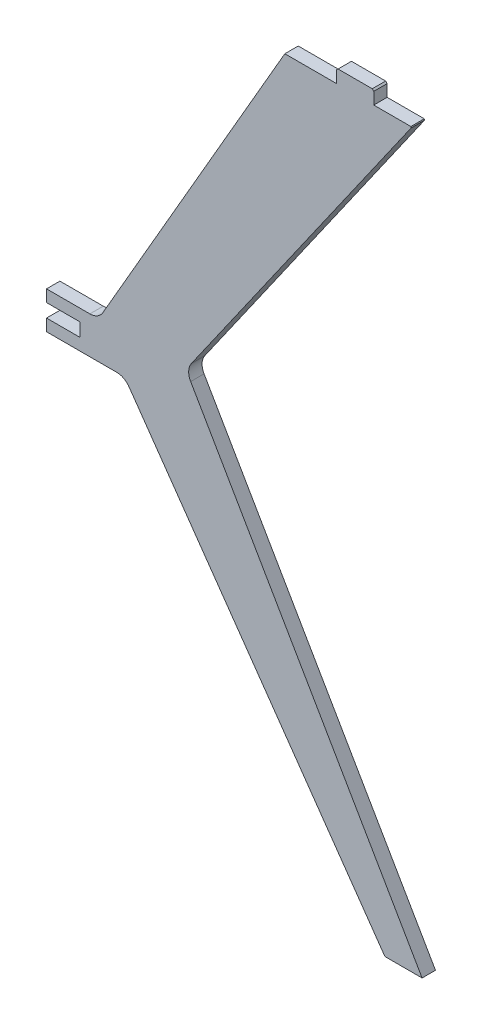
SolidWorks part; units mm, degrees
ref_plane "Alzado" through (0, 0, 0) normal (0, 0, 1) x (1, 0, 0)
ref_plane "Planta" through (0, 0, 0) normal (0, 1, 0) x (1, 0, 0)
ref_plane "Vista lateral" through (0, 0, 0) normal (1, 0, 0) x (0, 0, -1)
sketch "Croquis1" plane through (0, 0, 0) normal (0, 0, 1) x (1, 0, 0)
  line L0 (0, 0) -> (-317.5426, 550)
  line L4 (-400.1038, 500) -> (-50, 0)
  line L5 (-50, 0) -> (0, 0)
  line L6 (-400.1038, 500) -> (-505, 500)
  line L7 (-505, 550) -> (-505, 500) construction
  line L8 (-505, 550) -> (-435.1141, 550)
  line L9 (-435.1141, 550) -> (-184.5441, 984)
  line L10 (-400.1038, 500) -> (-435.1141, 550) construction
  line L11 (-505, 550) -> (-505, 534)
  line L12 (-505, 534) -> (-460, 534)
  line L13 (-460, 534) -> (-460, 516)
  line L14 (-460, 516) -> (-505, 516)
  line L15 (-505, 516) -> (-505, 500)
  line L16 (-460, 525) -> (-505, 525) construction
  line L17 (-317.5426, 550) -> (-13.6526, 984)
  line L18 (-184.5441, 984) -> (-13.6526, 984)
  line L19 (-435.1141, 550) -> (-317.5426, 550) construction
  dimension "D5" = 45
  dimension "D1" = 50
  dimension "D2" = 60
  dimension "D3" = 55
  dimension "D4" = 18
  dimension "D6" = 50
  dimension "D7" = 500
  dimension "D8" = 505
  dimension "D9" = 60
  dimension "D10" = 55
  dimension "D11" = 984
extrude "Saliente-Extruir1" add sketch "Croquis1" along normal blind 18
sketch "Croquis2" plane through (0, 984, 0) normal (0, 1, 0) x (1, 0, 0)
  line L0 (-65, -18) -> (-65, 0)
  line L1 (-135.391, -48.0884) -> (-134.2687, 14.5813) construction
  line L2 (-13.6526, -18) -> (-184.5441, -18) construction
  line L3 (-13.6526, 0) -> (-184.5441, 0) construction
  line L4 (-65, 0) -> (-115, 0)
  line L5 (-115, 0) -> (-115, -18)
  line L6 (-115, -12) -> (-115, 0) construction
  line L7 (-115, -18) -> (-65, -18)
extrude "Saliente-Extruir2" add sketch "Croquis2" along normal blind 18
chamfer "Chaflán1" distance 2 angle 45 3 edges at (-65, 1002, 9) (-115, 1002, 9) (-13.6526, 984, 9)
fillet "Redondeo1" radius 20 3 edges at (-317.5426, 550, 9) (-400.1038, 500, 9) (-435.1141, 550, 9)
